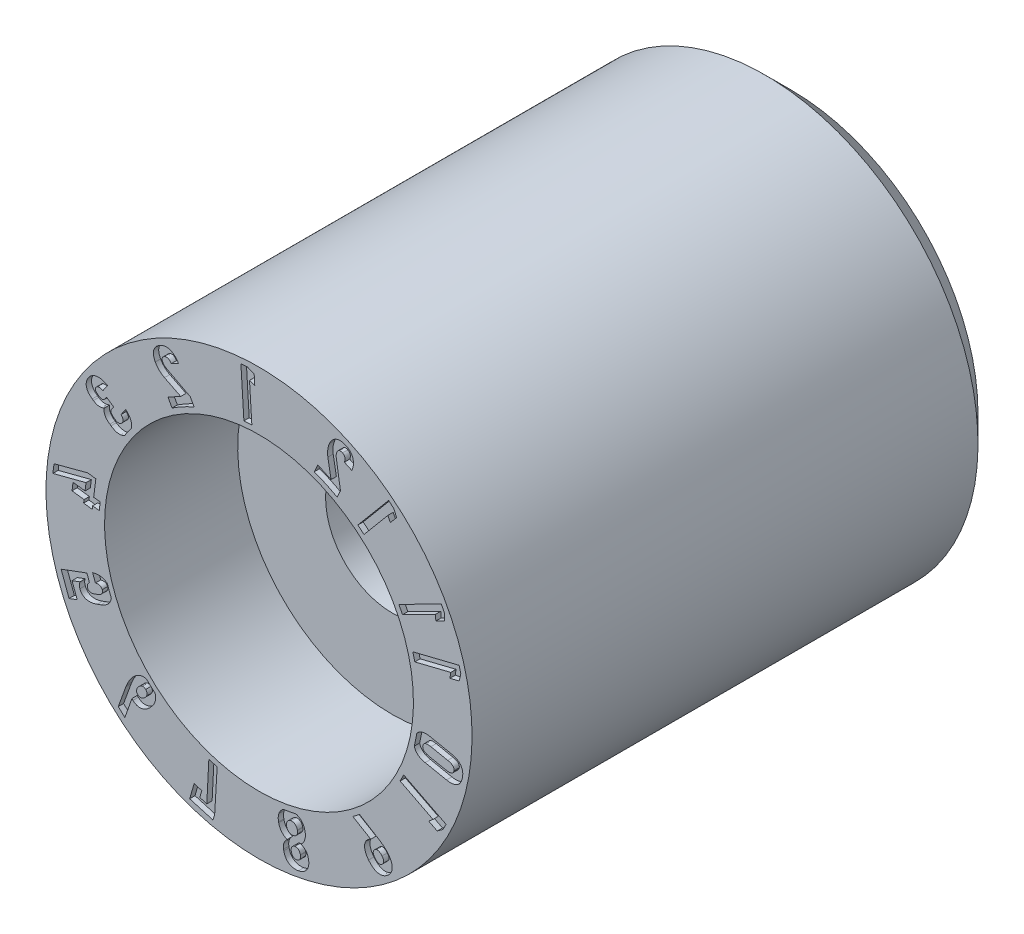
SolidWorks part; units mm, degrees
ref_plane "Front Plane" through (0, 0, 0) normal (0, 0, 1) x (1, 0, 0)
ref_plane "Top Plane" through (0, 0, 0) normal (0, 1, 0) x (1, 0, 0)
ref_plane "Right Plane" through (0, 0, 0) normal (1, 0, 0) x (0, 0, -1)
sketch "Sketch1" plane through (0, 0, 0) normal (1, 0, 0) x (0, 0, -1)
  line L0 (0, 0) -> (26.2054, 0) construction
  line L2 (10, 1.25) -> (10, 3.5)
  line L4 (9.5, 4) -> (0, 4)
  line L5 (0, 4) -> (0, 2.9)
  line L7 (0, 2.9) -> (2.5, 2.9)
  line L8 (2.5, 2.9) -> (2.5, 1.25)
  line L9 (2.5, 1.25) -> (10, 1.25)
  line L12 (10, 3.5) -> (9.5, 4)
  point P6 (10, 4)
  dimension "D1" = 10
  dimension "D2" = 8
  dimension "D3" = 5.8
  dimension "D4" = 2.5
  dimension "D5" = 2.5
revolve "Revolve1" add sketch "Sketch1" angle 360 about L0
sketch "Sketch2" plane through (0, 0, 0) normal (0, 0, 1) x (0, 1, 0)
  line L0 (2.9823, 0.2837) -> (2.9916, 0.1344)
  line L1 (2.9916, 0.1344) -> (3.6924, 0.1782)
  line L2 (3.6924, 0.1782) -> (3.6568, 0.0792)
  line L3 (3.6568, 0.0792) -> (3.8371, 0.0905)
  line L4 (3.8371, 0.0905) -> (3.8904, 0.2123)
  line L5 (3.8904, 0.2123) -> (3.8823, 0.3398)
  line L6 (3.8823, 0.3398) -> (2.9823, 0.2837)
  line L7 (2.8709, 1.2896) -> (3.0983, 1.7224)
  line L8 (3.176, 1.8085) -> (3.1771, 1.8091)
  line L9 (3.2309, 1.6473) -> (3.2303, 1.647)
  line L10 (3.2303, 1.647) -> (3.3033, 1.5118)
  line L11 (3.3033, 1.5118) -> (3.3039, 1.5121)
  line L12 (3.1083, 1.9472) -> (3.1077, 1.947)
  line L13 (2.9389, 1.7744) -> (2.786, 1.4692)
  line L14 (2.786, 1.4692) -> (2.6568, 1.7084)
  line L15 (2.6568, 1.7084) -> (2.5131, 1.6308)
  line L16 (2.5131, 1.6308) -> (2.7365, 1.2171)
  line L17 (2.7365, 1.2171) -> (2.8709, 1.2896)
  line L18 (2.0557, 2.5036) -> (1.9292, 2.5916)
  line L19 (1.7966, 2.703) -> (1.8086, 2.7203)
  line L20 (1.9296, 2.7674) -> (1.9848, 2.7291)
  line L21 (1.9848, 2.7291) -> (2.0786, 2.8638)
  line L22 (2.0786, 2.8638) -> (2.0234, 2.9021)
  line L23 (2.028, 3.0125) -> (2.0369, 3.0251)
  line L24 (2.1496, 2.9309) -> (2.2759, 2.8429)
  line L25 (1.9152, 3.1312) -> (1.8997, 3.1086)
  line L26 (1.6699, 2.8011) -> (1.6543, 2.7788)
  line L27 (0.6697, 3.2179) -> (0.5022, 3.8488)
  line L28 (0.5022, 3.8488) -> (0.3335, 3.8703)
  line L29 (0.3335, 3.8703) -> (0.4952, 3.2477)
  line L30 (0.4952, 3.2477) -> (0.3511, 3.2661)
  line L31 (0.1397, 3.293) -> (0.1191, 3.1312)
  line L32 (0.1191, 3.1312) -> (0.1811, 3.1233)
  line L33 (0.6499, 3.0635) -> (0.6697, 3.2179)
  line L34 (0.3799, 3.4918) -> (0.2306, 3.5108)
  line L35 (0.2306, 3.5108) -> (0.2018, 3.2851)
  line L36 (0.1636, 2.9859) -> (0.3129, 2.9668)
  line L37 (0.3129, 2.9668) -> (0.3304, 3.1043)
  line L38 (-0.9072, 3.123) -> (-0.9074, 3.1236)
  line L39 (-0.9074, 3.1236) -> (-1.0486, 3.0713)
  line L40 (-1.0486, 3.0713) -> (-1.0484, 3.0708)
  line L41 (-1.2093, 3.0183) -> (-1.2353, 3.089)
  line L42 (-1.0982, 3.1827) -> (-0.9662, 3.2316)
  line L43 (-0.9662, 3.2316) -> (-1.1453, 3.7154)
  line L44 (-1.1453, 3.7154) -> (-1.548, 3.5662)
  line L45 (-1.548, 3.5662) -> (-1.4914, 3.4135)
  line L46 (-1.4914, 3.4135) -> (-1.2299, 3.5103)
  line L47 (-1.2299, 3.5103) -> (-1.1748, 3.3615)
  line L48 (-1.3766, 3.0367) -> (-1.3505, 2.966)
  line L49 (-2.2305, 2.3717) -> (-2.2309, 2.3721)
  line L50 (-2.4509, 2.4996) -> (-2.8439, 2.6425)
  line L51 (-2.8439, 2.6425) -> (-2.9585, 2.5181)
  line L52 (-2.9585, 2.5181) -> (-2.5825, 2.385)
  line L54 (-2.5477, 2.0326) -> (-2.5472, 2.0321)
  line L55 (-2.4382, 2.135) -> (-2.4388, 2.1355)
  line L56 (-2.3261, 2.2566) -> (-2.3259, 2.2563)
  line L57 (-3.6901, 0.8321) -> (-2.8822, 0.7849)
  line L58 (-2.8822, 0.7849) -> (-2.837, 0.9415)
  line L59 (-2.837, 0.9415) -> (-3.5945, 0.98)
  line L60 (-3.5945, 0.98) -> (-3.5564, 1.1116)
  line L61 (-3.5564, 1.1116) -> (-3.4259, 1.0738)
  line L62 (-3.4259, 1.0738) -> (-3.3841, 1.2183)
  line L63 (-3.3841, 1.2183) -> (-3.672, 1.3015)
  line L64 (-3.672, 1.3015) -> (-3.7986, 0.8634)
  line L65 (-3.7986, 0.8634) -> (-3.6901, 0.8321)
  line L66 (-3.2132, -0.3668) -> (-3.2278, -0.3695)
  line L67 (-3.611, -0.4608) -> (-3.6342, -0.4652)
  line L68 (-3.544, -0.9296) -> (-3.5208, -0.9252)
  line L69 (-3.1313, -0.8662) -> (-3.1167, -0.8635)
  line L70 (-3.1697, -0.7205) -> (-3.1781, -0.7222)
  line L71 (-3.2166, -0.5207) -> (-3.2074, -0.5188)
  line L72 (-3.5426, -0.7762) -> (-3.5512, -0.7779)
  line L73 (-3.5834, -0.6087) -> (-3.5744, -0.6068)
  line L75 (-2.9881, -2.0574) -> (-2.9886, -2.0578)
  line L76 (-2.6982, -2.4217) -> (-2.6975, -2.4213)
  line L77 (-2.5398, -2.226) -> (-2.3243, -1.8752)
  line L78 (-2.3243, -1.8752) -> (-2.4224, -1.7507)
  line L79 (-2.4224, -1.7507) -> (-2.6294, -2.0994)
  line L80 (-2.7967, -2.3087) -> (-2.797, -2.309)
  line L81 (-2.8992, -2.1784) -> (-2.8988, -2.178)
  line L82 (-1.2724, -2.7122) -> (-1.4059, -2.6441)
  line L83 (-1.4059, -2.6441) -> (-1.7234, -3.267)
  line L84 (-1.7234, -3.267) -> (-1.7907, -3.1862)
  line L85 (-1.7907, -3.1862) -> (-1.8723, -3.3463)
  line L86 (-1.8723, -3.3463) -> (-1.7943, -3.4542)
  line L87 (-1.7943, -3.4542) -> (-1.6802, -3.5123)
  line L88 (-1.6802, -3.5123) -> (-1.2724, -2.7122)
  line L89 (-0.8731, -3.1195) -> (-0.9546, -3.5211)
  line L90 (-0.4859, -3.6161) -> (-0.4044, -3.2145)
  line L91 (-0.5608, -3.2271) -> (-0.6249, -3.5436)
  line L92 (-0.7984, -3.5085) -> (-0.7343, -3.192)
  line L93 (0.8116, -2.8836) -> (0.6656, -2.9195)
  line L94 (0.6656, -2.9195) -> (0.8338, -3.6005)
  line L95 (0.8338, -3.6005) -> (0.7295, -3.5837)
  line L96 (0.7295, -3.5837) -> (0.7727, -3.7586)
  line L97 (0.7727, -3.7586) -> (0.903, -3.7891)
  line L98 (0.903, -3.7891) -> (1.0277, -3.7583)
  line L99 (1.0277, -3.7583) -> (0.8116, -2.8836)
  line L100 (1.4495, -2.6218) -> (1.316, -2.6901)
  line L101 (1.316, -2.6901) -> (1.6341, -3.3132)
  line L102 (1.6341, -3.3132) -> (1.529, -3.3203)
  line L103 (1.529, -3.3203) -> (1.6107, -3.4806)
  line L104 (1.6107, -3.4806) -> (1.7441, -3.4805)
  line L105 (1.7441, -3.4805) -> (1.8582, -3.4222)
  line L106 (1.8582, -3.4222) -> (1.4495, -2.6218)
  line L107 (2.3539, -1.8525) -> (2.2574, -1.9675)
  line L108 (2.2574, -1.9675) -> (2.7968, -2.42)
  line L109 (2.7968, -2.42) -> (2.7026, -2.4672)
  line L110 (2.7026, -2.4672) -> (2.8413, -2.5836)
  line L111 (2.8413, -2.5836) -> (2.9642, -2.5318)
  line L112 (2.9642, -2.5318) -> (3.0466, -2.4338)
  line L113 (3.0466, -2.4338) -> (2.3539, -1.8525)
  line L114 (2.7506, -1.5296) -> (3.2347, -1.4526)
  line L115 (3.3507, -1.4635) -> (3.3518, -1.464)
  line L116 (3.2537, -1.6046) -> (3.2532, -1.6043)
  line L117 (3.2532, -1.6043) -> (3.1879, -1.7442)
  line L118 (3.1879, -1.7442) -> (3.1884, -1.7445)
  line L119 (3.4217, -1.3255) -> (3.421, -1.3253)
  line L120 (3.1813, -1.293) -> (2.8447, -1.3532)
  line L121 (2.8447, -1.3532) -> (2.96, -1.1056)
  line L122 (2.96, -1.1056) -> (2.8116, -1.0366)
  line L123 (2.8116, -1.0366) -> (2.612, -1.4651)
  line L124 (2.612, -1.4651) -> (2.7506, -1.5296)
  line L125 (0.3511, 3.2661) -> (0.3799, 3.4918)
  line L126 (0.2018, 3.2851) -> (0.1397, 3.293)
  line L127 (0.1811, 3.1233) -> (0.1636, 2.9859)
  line L128 (0.3304, 3.1043) -> (0.6499, 3.0635)
  circle A0 centre (0, 0) radius 3
  spline S0 degree 3 poles (3.0983, 1.7224) (3.1078, 1.7411) (3.1226, 1.7627) (3.1436, 1.7849) (3.1576, 1.7966) (3.1682, 1.8047) (3.176, 1.8085) knots 0 0 0 0 0.534648 0.661606 0.780088 1 1 1 1
  spline S1 degree 3 poles (3.1771, 1.8091) (3.1867, 1.814) (3.2017, 1.8205) (3.2224, 1.8209) (3.2366, 1.818) (3.2499, 1.8119) (3.267, 1.799) (3.2765, 1.7852) (3.2818, 1.7751) knots 0 0 0 0 0.26216 0.377952 0.49164 0.607228 0.726091 1 1 1 1
  spline S2 degree 3 poles (3.2818, 1.7751) (3.2874, 1.7651) (3.2927, 1.7483) (3.2916, 1.7253) (3.2866, 1.7084) (3.2778, 1.6921) (3.2608, 1.6696) (3.2434, 1.656) (3.2309, 1.6473) knots 0 0 0 0 0.226787 0.33568 0.449024 0.569877 0.698823 1 1 1 1
  spline S3 degree 3 poles (3.3039, 1.5121) (3.3265, 1.5257) (3.3574, 1.5489) (3.3928, 1.5843) (3.4141, 1.6117) (3.4314, 1.64) (3.4442, 1.6692) (3.4528, 1.6992) (3.4563, 1.7297) (3.4558, 1.7605) (3.4484, 1.8024) (3.4365, 1.8325) (3.4261, 1.8517) knots 0 0 0 0 0.196206 0.286284 0.372136 0.454136 0.532641 0.609085 0.684816 0.761082 0.837734 1 1 1 1
  spline S4 degree 3 poles (3.4261, 1.8517) (3.4151, 1.872) (3.3965, 1.9004) (3.366, 1.9319) (3.3421, 1.9508) (3.3167, 1.9655) (3.29, 1.9762) (3.2618, 1.9821) (3.2326, 1.9839) (3.2023, 1.9813) (3.1597, 1.9715) (3.1286, 1.9581) (3.1083, 1.9472) knots 0 0 0 0 0.184008 0.267648 0.34816 0.425105 0.500628 0.57575 0.653062 0.73272 0.816618 1 1 1 1
  spline S5 degree 3 poles (3.1077, 1.947) (3.0898, 1.9371) (3.0638, 1.9206) (3.032, 1.8943) (3.0093, 1.8729) (2.9885, 1.8498) (2.9637, 1.8178) (2.9478, 1.7922) (2.9389, 1.7744) knots 0 0 0 0 0.249859 0.376065 0.504448 0.631713 0.756364 1 1 1 1
  spline S6 degree 3 poles (1.7024, 2.4411) (1.7211, 2.428) (1.7508, 2.4116) (1.7929, 2.3975) (1.8244, 2.3917) (1.8559, 2.3901) (1.8873, 2.393) (1.9182, 2.4003) (1.9485, 2.4121) (1.9778, 2.4285) (2.016, 2.4569) (2.0407, 2.4839) (2.0557, 2.5036) knots 0 0 0 0 0.170815 0.251399 0.33065 0.409017 0.486552 0.564769 0.645605 0.728786 0.814907 1 1 1 1
  spline S7 degree 3 poles (1.9292, 2.5916) (1.9232, 2.5852) (1.9141, 2.576) (1.9004, 2.5664) (1.8903, 2.5609) (1.8801, 2.5567) (1.8699, 2.5538) (1.8596, 2.5527) (1.8494, 2.5525) (1.8394, 2.5543) (1.8259, 2.558) (1.8166, 2.5635) (1.8106, 2.5674) knots 0 0 0 0 0.197222 0.287984 0.373853 0.456136 0.534562 0.610691 0.686572 0.762056 0.838541 1 1 1 1
  spline S8 degree 3 poles (1.8106, 2.5674) (1.8002, 2.5748) (1.786, 2.5878) (1.775, 2.61) (1.7713, 2.6274) (1.7714, 2.6458) (1.7779, 2.6723) (1.7882, 2.6909) (1.7966, 2.703) knots 0 0 0 0 0.24929 0.362504 0.47497 0.59163 0.714899 1 1 1 1
  spline S9 degree 3 poles (1.8086, 2.7203) (1.8174, 2.7328) (1.8311, 2.7501) (1.8531, 2.7672) (1.8689, 2.7753) (1.8848, 2.7798) (1.9061, 2.7801) (1.921, 2.7734) (1.9296, 2.7674) knots 0 0 0 0 0.315089 0.447671 0.567684 0.678572 0.782571 1 1 1 1
  spline S10 degree 3 poles (2.0234, 2.9021) (2.0162, 2.9069) (2.0071, 2.9168) (2.0019, 2.9337) (2.001, 2.9477) (2.0032, 2.9628) (2.0108, 2.9854) (2.0205, 3.0017) (2.028, 3.0125) knots 0 0 0 0 0.210103 0.312415 0.423519 0.546125 0.680082 1 1 1 1
  spline S11 degree 3 poles (2.0369, 3.0251) (2.0441, 3.0351) (2.0553, 3.0494) (2.0739, 3.0624) (2.0873, 3.0688) (2.101, 3.0717) (2.1197, 3.071) (2.1326, 3.0647) (2.1403, 3.0594) knots 0 0 0 0 0.303621 0.43287 0.550798 0.662155 0.770241 1 1 1 1
  spline S12 degree 3 poles (2.1403, 3.0594) (2.1459, 3.0559) (2.1528, 3.0488) (2.1602, 3.0379) (2.164, 3.0285) (2.167, 3.0186) (2.1682, 3.0078) (2.1686, 2.9964) (2.1676, 2.9842) (2.1651, 2.9716) (2.16, 2.9533) (2.1541, 2.9398) (2.1496, 2.9309) knots 0 0 0 0 0.138657 0.208199 0.279976 0.353135 0.429318 0.510498 0.596778 0.687957 0.785966 1 1 1 1
  spline S13 degree 3 poles (2.2759, 2.8429) (2.2893, 2.8653) (2.3058, 2.8999) (2.3201, 2.9475) (2.3262, 2.9817) (2.3281, 3.0149) (2.3258, 3.0468) (2.3197, 3.0773) (2.309, 3.106) (2.2946, 3.1326) (2.2709, 3.166) (2.2472, 3.1862) (2.2305, 3.1982) knots 0 0 0 0 0.196716 0.287731 0.374805 0.458316 0.538069 0.615548 0.692163 0.768138 0.843835 1 1 1 1
  spline S14 degree 3 poles (2.2305, 3.1982) (2.2168, 3.2076) (2.1959, 3.2203) (2.1667, 3.2325) (2.1455, 3.2395) (2.1243, 3.2436) (2.1033, 3.2453) (2.0824, 3.2445) (2.0617, 3.2414) (2.0413, 3.2358) (2.0215, 3.2279) (2.0022, 3.2176) (1.9836, 3.205) (1.9655, 3.19) (1.9417, 3.166) (1.9253, 3.1458) (1.9152, 3.1312) knots 0 0 0 0 0.13587 0.198857 0.259085 0.31767 0.374959 0.431265 0.48845 0.545686 0.603723 0.662785 0.724044 0.787632 0.854771 1 1 1 1
  spline S15 degree 3 poles (1.8997, 3.1086) (1.8885, 3.0924) (1.8741, 3.0668) (1.8633, 3.0301) (1.8592, 3.0031) (1.8595, 2.9763) (1.8653, 2.941) (1.8759, 2.9161) (1.8851, 2.9007) knots 0 0 0 0 0.267895 0.394163 0.51705 0.637758 0.756044 1 1 1 1
  spline S16 degree 3 poles (1.8851, 2.9007) (1.8761, 2.9042) (1.8622, 2.9076) (1.8433, 2.9098) (1.8293, 2.9096) (1.8152, 2.9082) (1.8012, 2.9054) (1.7871, 2.9009) (1.7681, 2.8931) (1.7447, 2.8797) (1.708, 2.8501) (1.6841, 2.822) (1.6699, 2.8011) knots 0 0 0 0 0.112729 0.16714 0.221927 0.276606 0.332379 0.389706 0.449147 0.572454 0.703496 1 1 1 1
  spline S17 degree 3 poles (1.6543, 2.7788) (1.6405, 2.7585) (1.6219, 2.7276) (1.6059, 2.684) (1.5986, 2.6529) (1.596, 2.6224) (1.5977, 2.5928) (1.6042, 2.5641) (1.6152, 2.5364) (1.6308, 2.5101) (1.6578, 2.4759) (1.6837, 2.4543) (1.7024, 2.4411) knots 0 0 0 0 0.190185 0.276427 0.358419 0.436713 0.51228 0.587201 0.663375 0.741683 0.822754 1 1 1 1
  spline S18 degree 3 poles (-1.0336, 2.7899) (-1.0142, 2.7968) (-0.9871, 2.8113) (-0.9557, 2.8371) (-0.9356, 2.8595) (-0.9186, 2.8847) (-0.9054, 2.9126) (-0.896, 2.9431) (-0.8901, 2.9758) (-0.8884, 3.0105) (-0.8913, 3.0604) (-0.8994, 3.098) (-0.9072, 3.123) knots 0 0 0 0 0.155445 0.230851 0.306409 0.38227 0.459713 0.539287 0.622795 0.71047 0.801871 1 1 1 1
  spline S19 degree 3 poles (-1.0484, 3.0708) (-1.0444, 3.0563) (-1.041, 3.0349) (-1.0422, 3.0073) (-1.0465, 2.9894) (-1.0535, 2.9736) (-1.0676, 2.9559) (-1.0821, 2.9468) (-1.0928, 2.9431) knots 0 0 0 0 0.299835 0.430581 0.551555 0.666049 0.774575 1 1 1 1
  spline S20 degree 3 poles (-1.0928, 2.9431) (-1.104, 2.9389) (-1.122, 2.9357) (-1.1452, 2.9405) (-1.1611, 2.9486) (-1.1756, 2.9606) (-1.1941, 2.9828) (-1.2037, 3.0036) (-1.2093, 3.0183) knots 0 0 0 0 0.230736 0.338466 0.449164 0.568137 0.696942 1 1 1 1
  spline S21 degree 3 poles (-1.2353, 3.089) (-1.2411, 3.1037) (-1.247, 3.1255) (-1.2485, 3.154) (-1.246, 3.1721) (-1.2403, 3.188) (-1.2283, 3.2061) (-1.2139, 3.2145) (-1.204, 3.2183) knots 0 0 0 0 0.31636 0.449008 0.569722 0.680549 0.783419 1 1 1 1
  spline S22 degree 3 poles (-1.204, 3.2183) (-1.1945, 3.222) (-1.1796, 3.2253) (-1.1597, 3.2241) (-1.1455, 3.2207) (-1.1321, 3.2146) (-1.1149, 3.2033) (-1.1043, 3.1915) (-1.0982, 3.1827) knots 0 0 0 0 0.251986 0.372078 0.491574 0.612296 0.73371 1 1 1 1
  spline S23 degree 3 poles (-1.1748, 3.3615) (-1.1825, 3.3656) (-1.1955, 3.3697) (-1.2139, 3.3725) (-1.2288, 3.373) (-1.244, 3.3724) (-1.2638, 3.3698) (-1.2782, 3.366) (-1.2873, 3.3626) knots 0 0 0 0 0.227095 0.351044 0.481488 0.615032 0.745959 1 1 1 1
  spline S24 degree 3 poles (-1.2873, 3.3626) (-1.3057, 3.3561) (-1.3313, 3.3425) (-1.3596, 3.3174) (-1.3767, 3.2958) (-1.3901, 3.2716) (-1.3997, 3.2447) (-1.4053, 3.2153) (-1.4073, 3.1834) (-1.4053, 3.1494) (-1.3973, 3.0996) (-1.3862, 3.062) (-1.3766, 3.0367) knots 0 0 0 0 0.153113 0.225278 0.296313 0.368149 0.442249 0.520001 0.603337 0.692522 0.787561 1 1 1 1
  spline S25 degree 3 poles (-1.3505, 2.966) (-1.3409, 2.9408) (-1.3247, 2.9048) (-1.2964, 2.8624) (-1.2736, 2.836) (-1.249, 2.8139) (-1.2225, 2.7964) (-1.1943, 2.7834) (-1.1645, 2.7751) (-1.1333, 2.7714) (-1.0887, 2.7733) (-1.0555, 2.7819) (-1.0336, 2.7899) knots 0 0 0 0 0.19719 0.28652 0.3708 0.450893 0.526968 0.601591 0.676168 0.75191 0.829978 1 1 1 1
  spline S26 degree 3 poles (-2.1884, 2.018) (-2.1731, 2.0348) (-2.1526, 2.0615) (-2.1348, 2.1015) (-2.1261, 2.1312) (-2.1224, 2.1615) (-2.124, 2.192) (-2.1297, 2.2227) (-2.1408, 2.2534) (-2.1565, 2.2839) (-2.1842, 2.3256) (-2.2112, 2.3535) (-2.2305, 2.3717) knots 0 0 0 0 0.169199 0.24737 0.32346 0.39802 0.472472 0.549125 0.629344 0.713762 0.802905 1 1 1 1
  spline S27 degree 3 poles (-2.2309, 2.3721) (-2.2433, 2.3833) (-2.2629, 2.3996) (-2.2911, 2.4196) (-2.3376, 2.4499) (-2.3798, 2.4707) (-2.4144, 2.4855) knots 0 0 0 0 0.231614 0.352297 0.478376 1 1 1 1
  spline S28 degree 3 poles (-2.4144, 2.4855) (-2.4206, 2.4879) (-2.4325, 2.4933) (-2.4448, 2.4978) (-2.4509, 2.4996) knots 0 0 0 0 0.511303 1 1 1 1
  spline S29 degree 3 poles (-2.5825, 2.385) (-2.5905, 2.3794) (-2.5977, 2.3729) (-2.6043, 2.3658) knots 0.767038 0.767038 0.767038 0.767038 1 1 1 1
  spline S30 degree 3 poles (-2.6043, 2.3658) (-2.618, 2.3506) (-2.6361, 2.3262) (-2.6513, 2.2897) (-2.6578, 2.2622) (-2.6598, 2.234) (-2.657, 2.2054) (-2.6497, 2.1764) (-2.6379, 2.1472) (-2.6218, 2.118) (-2.5932, 2.078) (-2.5671, 2.0502) (-2.5477, 2.0326) knots 0 0 0 0 0.16101 0.235421 0.308506 0.381742 0.456067 0.533316 0.615065 0.702209 0.794637 1 1 1 1
  spline S31 degree 3 poles (-2.5472, 2.0321) (-2.5274, 2.0139) (-2.4968, 1.9894) (-2.4527, 1.9647) (-2.4207, 1.9515) (-2.3891, 1.9427) (-2.3578, 1.9392) (-2.327, 1.9403) (-2.2969, 1.9463) (-2.2678, 1.9571) (-2.2294, 1.9785) (-2.2041, 2.0012) (-2.1884, 2.018) knots 0 0 0 0 0.197416 0.287306 0.371657 0.451535 0.528162 0.602502 0.677266 0.75295 0.830513 1 1 1 1
  spline S32 degree 3 poles (-2.3082, 2.1282) (-2.3164, 2.1194) (-2.3303, 2.1078) (-2.3526, 2.1011) (-2.3694, 2.1001) (-2.3867, 2.1031) (-2.4112, 2.1128) (-2.4277, 2.1253) (-2.4382, 2.135) knots 0 0 0 0 0.245304 0.35595 0.467803 0.584427 0.710019 1 1 1 1
  spline S33 degree 3 poles (-2.4388, 2.1355) (-2.4506, 2.1468) (-2.467, 2.1639) (-2.4816, 2.1901) (-2.4874, 2.2085) (-2.4894, 2.2264) (-2.4852, 2.25) (-2.4758, 2.2658) (-2.4673, 2.2745) knots 0 0 0 0 0.30801 0.438104 0.556606 0.666435 0.772704 1 1 1 1
  spline S34 degree 3 poles (-2.4673, 2.2745) (-2.4593, 2.2834) (-2.4446, 2.2942) (-2.4214, 2.2996) (-2.4031, 2.2993) (-2.3843, 2.2945) (-2.3569, 2.2824) (-2.3383, 2.2675) (-2.3261, 2.2566) knots 0 0 0 0 0.22324 0.329763 0.441275 0.561816 0.691909 1 1 1 1
  spline S35 degree 3 poles (-2.3259, 2.2563) (-2.3155, 2.2464) (-2.3014, 2.2311) (-2.2898, 2.2075) (-2.2855, 2.1907) (-2.2852, 2.1739) (-2.2904, 2.1516) (-2.3003, 2.1368) (-2.3082, 2.1282) knots 0 0 0 0 0.293937 0.418673 0.535266 0.64684 0.758394 1 1 1 1
  spline S36 degree 3 poles (-2.9194, -0.5674) (-2.924, -0.544) (-2.9338, -0.51) (-2.9555, -0.4692) (-2.9746, -0.4425) (-2.9965, -0.419) (-3.0212, -0.3992) (-3.0486, -0.3836) (-3.0782, -0.3715) (-3.1099, -0.3636) (-3.1553, -0.359) (-3.1901, -0.3624) (-3.2132, -0.3668) knots 0 0 0 0 0.178884 0.262595 0.344479 0.423995 0.502243 0.58012 0.659706 0.740594 0.823476 1 1 1 1
  spline S37 degree 3 poles (-3.2278, -0.3695) (-3.2493, -0.374) (-3.2811, -0.3839) (-3.3195, -0.4058) (-3.3464, -0.4253) (-3.3702, -0.4481) (-3.3968, -0.4812) (-3.4109, -0.5096) (-3.4172, -0.5293) knots 0 0 0 0 0.254841 0.381028 0.510144 0.638013 0.760518 1 1 1 1
  spline S38 degree 3 poles (-3.4172, -0.5293) (-3.4287, -0.5158) (-3.4484, -0.4974) (-3.4794, -0.4793) (-3.5046, -0.4686) (-3.5309, -0.4611) (-3.5665, -0.4557) (-3.5935, -0.4576) (-3.611, -0.4608) knots 0 0 0 0 0.247097 0.371664 0.499381 0.62686 0.751354 1 1 1 1
  spline S39 degree 3 poles (-3.6342, -0.4652) (-3.6561, -0.4691) (-3.6874, -0.4792) (-3.7257, -0.4989) (-3.7506, -0.517) (-3.7723, -0.5378) (-3.7907, -0.5612) (-3.8054, -0.5869) (-3.8166, -0.6149) (-3.8239, -0.6448) (-3.8282, -0.6878) (-3.8253, -0.7207) (-3.821, -0.7426) knots 0 0 0 0 0.177214 0.260428 0.341701 0.421474 0.499588 0.577635 0.657211 0.738857 0.822088 1 1 1 1
  spline S40 degree 3 poles (-3.821, -0.7426) (-3.8171, -0.7647) (-3.8069, -0.7961) (-3.7872, -0.8344) (-3.7691, -0.8594) (-3.7483, -0.8811) (-3.725, -0.8995) (-3.6992, -0.914) (-3.6712, -0.9252) (-3.6414, -0.9325) (-3.5986, -0.937) (-3.5658, -0.9339) (-3.544, -0.9296) knots 0 0 0 0 0.178261 0.261511 0.34282 0.422627 0.500775 0.578473 0.658084 0.739765 0.822602 1 1 1 1
  spline S41 degree 3 poles (-3.5208, -0.9252) (-3.503, -0.9219) (-3.4771, -0.913) (-3.4456, -0.8946) (-3.4243, -0.8772) (-3.405, -0.8579) (-3.3836, -0.8289) (-3.3724, -0.8045) (-3.3672, -0.7874) knots 0 0 0 0 0.250873 0.375914 0.503188 0.630627 0.753796 1 1 1 1
  spline S42 degree 3 poles (-3.3672, -0.7874) (-3.3536, -0.8034) (-3.3299, -0.8249) (-3.2926, -0.8458) (-3.2621, -0.8581) (-3.23, -0.8669) (-3.1861, -0.8725) (-3.1529, -0.8705) (-3.1313, -0.8662) knots 0 0 0 0 0.241586 0.363924 0.491458 0.62023 0.746403 1 1 1 1
  spline S43 degree 3 poles (-3.1167, -0.8635) (-3.0936, -0.8589) (-3.06, -0.849) (-3.0198, -0.8274) (-2.9935, -0.8082) (-2.9702, -0.7863) (-2.9511, -0.7612) (-2.9353, -0.7338) (-2.9239, -0.7038) (-2.916, -0.6719) (-2.9117, -0.626) (-2.9149, -0.5909) (-2.9194, -0.5674) knots 0 0 0 0 0.177114 0.259567 0.34073 0.420043 0.498008 0.576223 0.655896 0.737584 0.821334 1 1 1 1
  spline S44 degree 3 poles (-3.0799, -0.5986) (-3.0781, -0.608) (-3.0768, -0.6223) (-3.0793, -0.6408) (-3.083, -0.6539) (-3.0885, -0.6662) (-3.0958, -0.6775) (-3.1045, -0.688) (-3.1152, -0.697) (-3.1269, -0.7052) (-3.1448, -0.7143) (-3.1595, -0.7185) (-3.1697, -0.7205) knots 0 0 0 0 0.169074 0.249699 0.328832 0.40812 0.486189 0.565264 0.647423 0.731373 0.816867 1 1 1 1
  spline S45 degree 3 poles (-3.1781, -0.7222) (-3.1875, -0.7239) (-3.2017, -0.7252) (-3.2201, -0.7233) (-3.233, -0.7199) (-3.2449, -0.7149) (-3.2561, -0.7088) (-3.2661, -0.7007) (-3.275, -0.6913) (-3.2827, -0.6805) (-3.2916, -0.6641) (-3.2955, -0.6502) (-3.2974, -0.6408) knots 0 0 0 0 0.176681 0.260033 0.341553 0.420596 0.498534 0.576399 0.656491 0.737823 0.820739 1 1 1 1
  spline S46 degree 3 poles (-3.2974, -0.6408) (-3.2993, -0.6313) (-3.3005, -0.6171) (-3.2987, -0.5985) (-3.2955, -0.5856) (-3.2906, -0.5735) (-3.2842, -0.5624) (-3.2762, -0.5524) (-3.2668, -0.5432) (-3.256, -0.5353) (-3.2396, -0.5265) (-3.2259, -0.5226) (-3.2166, -0.5207) knots 0 0 0 0 0.177301 0.261425 0.342062 0.421703 0.500317 0.577975 0.658273 0.740753 0.823447 1 1 1 1
  spline S47 degree 3 poles (-3.2074, -0.5188) (-3.1973, -0.5169) (-3.1821, -0.5154) (-3.1623, -0.5169) (-3.1485, -0.5202) (-3.1354, -0.5248) (-3.1235, -0.5311) (-3.1127, -0.539) (-3.1032, -0.5484) (-3.0951, -0.5593) (-3.0857, -0.5755) (-3.0818, -0.5893) (-3.0799, -0.5986) knots 0 0 0 0 0.182585 0.268836 0.352094 0.433435 0.512647 0.590514 0.669615 0.749249 0.830155 1 1 1 1
  spline S48 degree 3 poles (-3.459, -0.6722) (-3.4574, -0.6802) (-3.4566, -0.6923) (-3.459, -0.7081) (-3.4626, -0.7192) (-3.4677, -0.7296) (-3.4744, -0.7392) (-3.4824, -0.7481) (-3.4922, -0.7559) (-3.5032, -0.7627) (-3.5196, -0.7708) (-3.5333, -0.7743) (-3.5426, -0.7762) knots 0 0 0 0 0.16279 0.241206 0.317594 0.394654 0.472304 0.551043 0.634187 0.71981 0.809266 1 1 1 1
  spline S49 degree 3 poles (-3.5512, -0.7779) (-3.56, -0.7795) (-3.5732, -0.7811) (-3.5903, -0.7795) (-3.6022, -0.7772) (-3.6133, -0.7734) (-3.6235, -0.7682) (-3.6326, -0.7616) (-3.6408, -0.7537) (-3.6478, -0.7447) (-3.6555, -0.7309) (-3.6593, -0.7194) (-3.6608, -0.7113) knots 0 0 0 0 0.186052 0.273036 0.3566 0.43768 0.515173 0.593465 0.671426 0.750702 0.830172 1 1 1 1
  spline S50 degree 3 poles (-3.6608, -0.7113) (-3.6624, -0.7034) (-3.6633, -0.6913) (-3.6613, -0.6756) (-3.6582, -0.6646) (-3.6533, -0.6543) (-3.6473, -0.6447) (-3.6397, -0.636) (-3.6308, -0.6283) (-3.6205, -0.6216) (-3.605, -0.614) (-3.5922, -0.6104) (-3.5834, -0.6087) knots 0 0 0 0 0.168146 0.248098 0.326624 0.404577 0.482601 0.560758 0.642457 0.726402 0.814012 1 1 1 1
  spline S51 degree 3 poles (-3.5744, -0.6068) (-3.5652, -0.605) (-3.5514, -0.6037) (-3.5334, -0.6047) (-3.5208, -0.6071) (-3.5091, -0.6108) (-3.4982, -0.6157) (-3.4887, -0.6223) (-3.4799, -0.6299) (-3.4726, -0.6389) (-3.4643, -0.6526) (-3.4604, -0.6641) (-3.459, -0.6722) knots 0 0 0 0 0.189229 0.277924 0.362657 0.445763 0.525058 0.602259 0.679372 0.756887 0.835452 1 1 1 1
  spline S52 degree 3 poles (-2.6294, -2.0994) (-2.6296, -2.0987) (-2.6316, -2.0929) (-2.6387, -2.0764) (-2.6485, -2.0621) (-2.6557, -2.0527) knots 0.575994 0.575994 0.575994 0.575994 0.592744 0.720736 1 1 1 1
  spline S53 degree 3 poles (-2.6557, -2.0527) (-2.6674, -2.0377) (-2.688, -2.0176) (-2.7208, -1.9989) (-2.747, -1.9892) (-2.7747, -1.9836) (-2.8036, -1.9816) (-2.8336, -1.9846) (-2.8644, -1.991) (-2.8956, -2.0017) (-2.9385, -2.0216) (-2.9685, -2.0422) (-2.9881, -2.0574) knots 0 0 0 0 0.154016 0.228362 0.302765 0.378156 0.455155 0.535205 0.619794 0.708332 0.800167 1 1 1 1
  spline S54 degree 3 poles (-2.9886, -2.0578) (-3.0101, -2.0745) (-3.0392, -2.1014) (-3.0711, -2.1413) (-3.0895, -2.1709) (-3.1033, -2.201) (-3.1117, -2.2316) (-3.1159, -2.2622) (-3.1145, -2.2929) (-3.1086, -2.3235) (-3.0934, -2.3649) (-3.0753, -2.3936) (-3.061, -2.4117) knots 0 0 0 0 0.198893 0.288574 0.373322 0.453436 0.529989 0.604248 0.67861 0.753886 0.831689 1 1 1 1
  spline S55 degree 3 poles (-3.061, -2.4117) (-3.0469, -2.4296) (-3.0232, -2.4538) (-2.9864, -2.478) (-2.9579, -2.4908) (-2.928, -2.4987) (-2.897, -2.502) (-2.8651, -2.5005) (-2.8324, -2.494) (-2.7991, -2.4828) (-2.7525, -2.4612) (-2.7196, -2.4385) (-2.6982, -2.4217) knots 0 0 0 0 0.166728 0.244252 0.31951 0.393956 0.468582 0.545592 0.62596 0.711038 0.800824 1 1 1 1
  spline S56 degree 3 poles (-2.6975, -2.4213) (-2.6853, -2.4115) (-2.6672, -2.3955) (-2.6448, -2.3715) (-2.6277, -2.3516) (-2.6106, -2.33) (-2.5871, -2.2985) (-2.5702, -2.2737) (-2.5592, -2.2564) knots 0 0 0 0 0.217794 0.334091 0.455146 0.582325 0.716135 1 1 1 1
  spline S57 degree 3 poles (-2.5592, -2.2564) (-2.5556, -2.2515) (-2.549, -2.2415) (-2.5425, -2.2313) (-2.5398, -2.226) knots 0 0 0 0 0.504892 1 1 1 1
  spline S58 degree 3 poles (-2.7611, -2.1754) (-2.7535, -2.1846) (-2.7451, -2.2007) (-2.7427, -2.2243) (-2.7456, -2.2418) (-2.7524, -2.2592) (-2.7677, -2.2835) (-2.7845, -2.2989) (-2.7967, -2.3087) knots 0 0 0 0 0.23112 0.338282 0.450449 0.569092 0.696707 1 1 1 1
  spline S59 degree 3 poles (-2.797, -2.309) (-2.809, -2.3181) (-2.8272, -2.3305) (-2.8537, -2.339) (-2.8718, -2.3411) (-2.8889, -2.3392) (-2.9108, -2.331) (-2.9241, -2.3188) (-2.9315, -2.3095) knots 0 0 0 0 0.298944 0.427128 0.544956 0.655458 0.764763 1 1 1 1
  spline S60 degree 3 poles (-2.9315, -2.3095) (-2.939, -2.3002) (-2.9477, -2.2842) (-2.9507, -2.2608) (-2.9483, -2.2435) (-2.9417, -2.2265) (-2.9273, -2.2027) (-2.911, -2.1879) (-2.8992, -2.1784) knots 0 0 0 0 0.237054 0.346024 0.457056 0.575514 0.70263 1 1 1 1
  spline S61 degree 3 poles (-2.8988, -2.178) (-2.8864, -2.1685) (-2.8676, -2.1557) (-2.8404, -2.1467) (-2.8221, -2.144) (-2.8045, -2.1457) (-2.7822, -2.1537) (-2.7685, -2.1658) (-2.7611, -2.1754) knots 0 0 0 0 0.303047 0.430569 0.548072 0.658718 0.767758 1 1 1 1
  spline S62 degree 3 poles (-0.588, -2.9161) (-0.606, -2.9124) (-0.6328, -2.9086) (-0.6679, -2.9094) (-0.6923, -2.9117) (-0.7152, -2.9171) (-0.737, -2.9245) (-0.7574, -2.9345) (-0.7764, -2.9471) (-0.7939, -2.9618) (-0.8102, -2.9783) (-0.8246, -2.997) (-0.8374, -3.0177) (-0.849, -3.0402) (-0.8621, -3.074) (-0.8696, -3.1008) (-0.8731, -3.1195) knots 0 0 0 0 0.138731 0.202567 0.263498 0.322469 0.379456 0.436177 0.493195 0.550174 0.607994 0.667008 0.727572 0.791206 0.856989 1 1 1 1
  spline S63 degree 3 poles (-0.9546, -3.5211) (-0.9583, -3.5398) (-0.9624, -3.5677) (-0.9631, -3.6042) (-0.9614, -3.6296) (-0.9575, -3.6538) (-0.9513, -3.6766) (-0.943, -3.6982) (-0.9324, -3.7184) (-0.9198, -3.7373) (-0.9046, -3.7541) (-0.8877, -3.7696) (-0.8683, -3.7829) (-0.8471, -3.795) (-0.8149, -3.8086) (-0.789, -3.8158) (-0.771, -3.8194) knots 0 0 0 0 0.143926 0.210759 0.274072 0.335414 0.394353 0.45189 0.509036 0.565515 0.622053 0.679039 0.73782 0.798427 0.86186 1 1 1 1
  spline S64 degree 3 poles (-0.771, -3.8194) (-0.753, -3.8232) (-0.7262, -3.8263) (-0.6912, -3.8266) (-0.6669, -3.8239) (-0.644, -3.8189) (-0.6223, -3.8116) (-0.6019, -3.8017) (-0.5828, -3.7897) (-0.5654, -3.775) (-0.5492, -3.7586) (-0.5347, -3.7398) (-0.5219, -3.719) (-0.5102, -3.6963) (-0.4969, -3.6622) (-0.4897, -3.635) (-0.4859, -3.6161) knots 0 0 0 0 0.138147 0.201977 0.262447 0.321467 0.378091 0.43441 0.490871 0.547386 0.605149 0.664105 0.725062 0.788634 0.85527 1 1 1 1
  spline S65 degree 3 poles (-0.4044, -3.2145) (-0.4007, -3.1958) (-0.3966, -3.1679) (-0.3959, -3.1314) (-0.3976, -3.106) (-0.4016, -3.082) (-0.4078, -3.0591) (-0.4161, -3.0375) (-0.4267, -3.0173) (-0.4395, -2.9985) (-0.4544, -2.9814) (-0.4715, -2.966) (-0.4908, -2.9526) (-0.512, -2.9405) (-0.5442, -2.927) (-0.57, -2.9195) (-0.588, -2.9161) knots 0 0 0 0 0.143965 0.210816 0.274146 0.335115 0.39407 0.451623 0.508784 0.565664 0.622004 0.679439 0.737787 0.798867 0.862317 1 1 1 1
  spline S66 degree 3 poles (-0.6205, -3.0765) (-0.6135, -3.0778) (-0.6035, -3.081) (-0.5913, -3.0871) (-0.5833, -3.0927) (-0.5765, -3.0993) (-0.5703, -3.1065) (-0.5654, -3.115) (-0.5599, -3.1276) (-0.5555, -3.1459) (-0.5534, -3.1806) (-0.5567, -3.2081) (-0.5608, -3.2271) knots 0 0 0 0 0.116632 0.170745 0.222884 0.274115 0.325966 0.378133 0.43327 0.550995 0.682398 1 1 1 1
  spline S67 degree 3 poles (-0.6249, -3.5436) (-0.6288, -3.5626) (-0.6361, -3.5894) (-0.6517, -3.6206) (-0.6647, -3.6382) (-0.6801, -3.6514) (-0.7045, -3.6624) (-0.7253, -3.6618) (-0.7385, -3.6591) knots 0 0 0 0 0.318221 0.450597 0.568225 0.675116 0.777705 1 1 1 1
  spline S68 degree 3 poles (-0.7385, -3.6591) (-0.7454, -3.6575) (-0.7557, -3.655) (-0.7677, -3.6484) (-0.7756, -3.6429) (-0.7826, -3.6366) (-0.7886, -3.6291) (-0.7937, -3.6209) (-0.7989, -3.6081) (-0.8033, -3.5899) (-0.8061, -3.555) (-0.8019, -3.5275) (-0.7984, -3.5085) knots 0 0 0 0 0.116595 0.170753 0.222856 0.273709 0.324641 0.377579 0.431958 0.5496 0.682718 1 1 1 1
  spline S69 degree 3 poles (-0.7343, -3.192) (-0.7304, -3.1729) (-0.723, -3.1462) (-0.7071, -3.1152) (-0.6942, -3.0977) (-0.679, -3.0843) (-0.6545, -3.0735) (-0.6338, -3.0736) (-0.6205, -3.0765) knots 0 0 0 0 0.318458 0.450036 0.567771 0.674303 0.776986 1 1 1 1
  spline S70 degree 3 poles (3.2347, -1.4526) (3.2555, -1.4494) (3.2952, -1.4469) (3.334, -1.456) (3.3507, -1.4635) knots 0 0 0 0 0.536054 1 1 1 1
  spline S71 degree 3 poles (3.3518, -1.464) (3.3618, -1.4686) (3.3753, -1.4774) (3.3884, -1.4934) (3.3945, -1.5065) (3.3975, -1.521) (3.3973, -1.5426) (3.3916, -1.5586) (3.3869, -1.5691) knots 0 0 0 0 0.261235 0.376365 0.489449 0.603513 0.724398 1 1 1 1
  spline S72 degree 3 poles (3.3869, -1.5691) (3.382, -1.5795) (3.3719, -1.5938) (3.3527, -1.6065) (3.3362, -1.6127) (3.3178, -1.6158) (3.2896, -1.6151) (3.2681, -1.6096) (3.2537, -1.6046) knots 0 0 0 0 0.225876 0.33463 0.447816 0.568931 0.699198 1 1 1 1
  spline S73 degree 3 poles (3.1884, -1.7445) (3.2128, -1.7545) (3.2499, -1.7657) (3.2995, -1.7731) (3.3343, -1.7738) (3.3674, -1.7706) (3.3987, -1.7636) (3.4278, -1.7521) (3.4547, -1.7367) (3.479, -1.7176) (3.5086, -1.6867) (3.5254, -1.6588) (3.5347, -1.6389) knots 0 0 0 0 0.195777 0.285691 0.371463 0.453331 0.531805 0.608367 0.684403 0.760622 0.837227 1 1 1 1
  spline S74 degree 3 poles (3.5347, -1.6389) (3.5446, -1.6179) (3.5563, -1.5859) (3.5636, -1.5423) (3.5644, -1.5117) (3.5611, -1.4825) (3.5535, -1.4546) (3.5414, -1.4284) (3.5254, -1.4036) (3.5054, -1.3807) (3.472, -1.3522) (3.4427, -1.3351) (3.4217, -1.3255) knots 0 0 0 0 0.184119 0.268257 0.34852 0.425742 0.500921 0.576347 0.653464 0.733373 0.816721 1 1 1 1
  spline S75 degree 3 poles (3.421, -1.3253) (3.4025, -1.3169) (3.3738, -1.3057) (3.3337, -1.296) (3.3029, -1.2908) (3.2719, -1.2877) (3.2312, -1.2871) (3.201, -1.2896) (3.1813, -1.293) knots 0 0 0 0 0.249373 0.375058 0.503349 0.630685 0.755656 1 1 1 1
  dimension "D1" = 6
extrude "Cut-Extrude1" cut sketch "Sketch2" against normal blind 0.1 contours L54 S31 A0 S26 L49 S27 S28 L50 L51 L52 S29 S30 L56 S35 S32 L55 S33 S34 | L48 S25 A0 S18 L38 L39 L40 S19 S20 L41 S21 S22 L42 L43 L44 L45 L46 L47 S23 S24 | A0 L37 L128 L33 L27 L28 L29 L30 L125 L34 L35 L126 L31 L32 L127 | A0 L59 L60 L61 L62 L63 L64 L65 L57 | L26 S17 A0 S6 L18 S7 S8 L19 S9 L20 L21 L22 S10 L23 S11 S12 L24 S13 S14 L25 S15 S16 | L12 S5 L13 L14 L15 A0 L17 L7 S0 L8 S1 S2 L9 L10 L11 S3 S4 | L69 S43 A0 S36 L66 S37 S38 L67 S39 S40 L68 S41 S42 L71 S47 S44 L70 S45 S46 L73 S51 S48 L72 S49 S50 | S56 S57 L77 A0 L79 S52 S53 L75 S54 S55 L76 L81 S61 S58 L80 S59 S60 | A0 L83 L84 L85 L86 L87 L88 | L90 S65 A0 S62 L89 S63 S64 L92 S69 S66 L91 S67 S68 | A0 L94 L95 L96 L97 L98 L99 | A0 L101 L102 L103 L104 L105 L106 | A0 L108 L109 L110 L111 L112 L113 | L119 S75 L120 L121 L122 A0 L124 L114 S70 L115 S71 S72 L116 L117 L118 S73 S74 | L4 L5 L6 L0 L1 L2 L3
